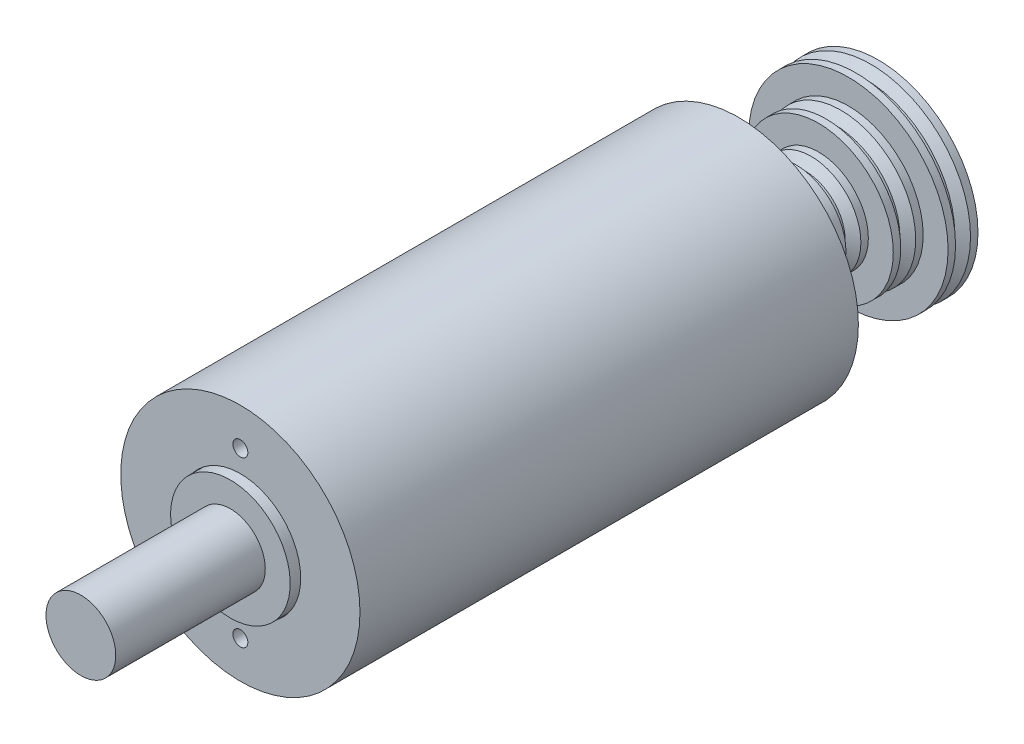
SolidWorks part; units mm, degrees
other "Spacer"
other "6201 DgFr"
other "Front Preload Nut"
other "7203 AngRr"
other "7203 AngFr"
other "Inner Spindle"
other "Lockring Rear"
other "Lockring Front"
other "Outer Spindle"
other "Rear Preload Nut"
other "6201 DgRr"
other "Pulley"
ref_plane "Front Plane" through (0, 0, 0) normal (0, 0, 1) x (1, 0, 0)
ref_plane "Top Plane" through (0, 0, 0) normal (0, 1, 0) x (1, 0, 0)
ref_plane "Right Plane" through (0, 0, 0) normal (1, 0, 0) x (0, 0, -1)
sketch "Sketch1" plane through (0, 0, 0) normal (1, 0, 0) x (0, 0, -1)
  line L0 (-126.3943, 0) -> (126.3943, 0) construction
  line L1 (-50, 23.3253) -> (-50, -23.3253) construction
  line L2 (50, 19.03) -> (50, -19.03) construction
  line L3 (-82, 0) -> (-82, 7)
  line L4 (-82, 7) -> (-52, 7)
  line L5 (-52, 7) -> (-52, 12)
  line L6 (-52, 12) -> (-48, 12)
  line L7 (-48, 12) -> (-48, 7.4)
  line L8 (-48, 7.4) -> (-44, 7.4)
  line L9 (-44, 7.4) -> (-44, 11)
  line L10 (-44, 11) -> (-40, 11)
  line L11 (-40, 11) -> (-40, 8.5)
  line L12 (-40, 8.5) -> (-16, 8.5)
  line L15 (-1, 8.45) -> (-1, 7.4)
  line L17 (-1, 7.4) -> (9, 7.4)
  line L18 (9, 7.4) -> (9, 6)
  line L21 (53, 5.95) -> (53, 5)
  line L22 (53, 5) -> (78, 5)
  line L23 (78, 5) -> (78, 0)
  line L24 (-82, 0) -> (78, 0)
  line L26 (-16, 7.5) -> (-14, 7.5)
  line L27 (-14, 7.5) -> (-14, 8.45)
  line L28 (-14, 8.45) -> (-1, 8.45)
  line L29 (9, 6) -> (39, 6)
  line L30 (39, 6) -> (39, 5)
  line L31 (39, 5) -> (41, 5)
  line L32 (41, 5) -> (41, 5.95)
  line L33 (41, 5.95) -> (53, 5.95)
  line L34 (-16, 8.5) -> (-16, 7.5)
  point P4 (0, 0)
  point P7 (-50, 0)
  point P10 (50, 0)
  point P38 (-16, 8)
  dimension "D1" = 50
  dimension "D2" = 50
  dimension "D3" = 7
  dimension "D4" = 30
  dimension "D5" = 12
  dimension "D6" = 4
  dimension "D7" = 7.4
  dimension "D8" = 2
  dimension "D9" = 6
  dimension "D10" = 11
  dimension "D11" = 4
  dimension "D12" = 8.5
  dimension "D13" = 24
  dimension "D14" = 8.45
  dimension "D15" = 2
  dimension "D16" = 15
  dimension "D17" = 41
  dimension "D18" = 6
  dimension "D19" = 7.5
  dimension "D20" = 30
  dimension "D21" = 7.4
  dimension "D22" = 3
  dimension "D23" = 5
  dimension "D24" = 25
  dimension "D25" = 5.95
  dimension "D26" = 2
  dimension "D27" = 5
revolve "Revolve2" add sketch "Sketch1" angle 360 about L0
sketch "Sketch5" plane through (0, 0, 40) normal (0, 0, -1) x (-1, 0, 0)
  circle A0 centre (0, 0) radius 8.5 construction
  circle A1 centre (0, 0) radius 8.5
  circle A2 centre (0, 0) radius 20
  dimension "D1" = 40
extrude "Boss-Extrude1" add sketch "Sketch5" along normal blind 12 separate body
sketch "Sketch6" plane through (0, 0, 28) normal (0, 0, -1) x (-1, 0, 0)
  circle A0 centre (0, 0) radius 8.5 construction
  circle A1 centre (0, 0) radius 8.5
  circle A2 centre (0, 0) radius 20
  dimension "D1" = 40
extrude "Boss-Extrude2" add sketch "Sketch6" along normal blind 12 separate body
sketch "Sketch7" plane through (0, 0, 16) normal (0, 0, -1) x (-1, 0, 0)
  circle A2 centre (0, 0) radius 12
  circle A7 centre (0, 0) radius 9
  circle A8 centre (0, 0) radius 9
  dimension "D1" = 24
  dimension "D2" = 0.5
extrude "Boss-Extrude3" add sketch "Sketch7" along normal blind 2 separate body
sketch "Sketch8" plane through (0, 0, 14) normal (0, 0, -1) x (-1, 0, 0)
  circle A0 centre (0, 0) radius 17.5
  circle A5 centre (0, 0) radius 8.45 construction
  circle A6 centre (0, 0) radius 8.45 construction
  circle A7 centre (0, 0) radius 8.05
  dimension "D1" = 35
  dimension "D2" = 16.1
extrude "Boss-Extrude4" add sketch "Sketch8" along normal blind 8
sketch "Sketch32" plane through (0, 0, 6) normal (0, 0, -1) x (-1, 0, 0)
  line L0 (0, -13) -> (0, 13) construction
  circle A0 centre (0, 0) radius 13 construction
  circle A2 centre (0, -13) radius 1.6
  circle A3 centre (0, 13) radius 1.6
  dimension "D1" = 26
  dimension "D2" = 3.2
extrude "Cut-Extrude9" cut sketch "Sketch32" against normal blind 5
sketch "Sketch9" plane through (0, 0, -9) normal (0, 0, -1) x (-1, 0, 0)
  circle A0 centre (0, 0) radius 6 construction
  circle A1 centre (0, 0) radius 6
  circle A2 centre (0, 0) radius 16
  dimension "D1" = 32
extrude "Boss-Extrude5" add sketch "Sketch9" along normal blind 10 separate body
sketch "Sketch11" plane through (0, 0, -19) normal (0, 0, -1) x (-1, 0, 0)
  circle A0 centre (0, 0) radius 16 construction
  circle A1 centre (0, 0) radius 16
  circle A2 centre (0, 0) radius 14
  circle A3 centre (0, 0) radius 15.5
  dimension "D1" = 28
  dimension "D2" = 31
extrude "Boss-Extrude8" add sketch "Sketch11" along normal blind 10 separate body contours A3 A2
sketch "Sketch12" plane through (0, 0, -29) normal (0, 0, -1) x (-1, 0, 0)
  circle A0 centre (0, 0) radius 6 construction
  circle A1 centre (0, 0) radius 6
  circle A2 centre (0, 0) radius 16
  dimension "D1" = 32
extrude "Boss-Extrude9" add sketch "Sketch12" along normal blind 10 separate body
sketch "Sketch13" plane through (0, 0, -39) normal (0, 0, -1) x (-1, 0, 0)
  circle A2 centre (0, 0) radius 8
  circle A5 centre (0, 0) radius 6.5
  circle A6 centre (0, 0) radius 6.5
  dimension "D1" = 16
  dimension "D2" = 0.5
extrude "Boss-Extrude10" add sketch "Sketch13" along normal blind 2 separate body
sketch "Sketch14" plane through (0, 0, -41) normal (0, 0, -1) x (-1, 0, 0)
  circle A0 centre (0, 0) radius 12
  circle A5 centre (0, 0) radius 5.55
  dimension "D1" = 24
  dimension "D2" = 11.1
extrude "Boss-Extrude11" add sketch "Sketch14" along normal blind 8
sketch "Sketch33" plane through (0, 0, -49) normal (0, 0, -1) x (-1, 0, 0)
  line L0 (0, 8.75) -> (0, -8.75) construction
  circle A0 centre (0, 0) radius 8.75 construction
  circle A1 centre (0, -8.75) radius 1.6
  circle A2 centre (0, 8.75) radius 1.6
  dimension "D1" = 17.5
  dimension "D2" = 3.2
extrude "Cut-Extrude10" cut sketch "Sketch33" against normal blind 5
sketch "Sketch15" plane through (0, 0, 0) normal (0, 0, 1) x (1, 0, 0)
  circle A0 centre (0, 0) radius 24
  dimension "D1" = 48
extrude "Boss-Extrude12" add sketch "Sketch15" along normal mid plane 100 separate body
sketch "Sketch16" plane through (0, 0, -50) normal (0, 0, -1) x (-1, 0, 0)
  circle A0 centre (0, 0) radius 16
  dimension "D1" = 32
extrude "Cut-Extrude1" cut sketch "Sketch16" against normal up to next (100 mm away)
sketch "Sketch17" plane through (0, 0, -50) normal (0, 0, -1) x (-1, 0, 0)
  circle A0 centre (0, 0) radius 21
  circle A1 centre (0, 0) radius 16 construction
  circle A2 centre (0, 0) radius 16
  dimension "D1" = 42
extrude "Cut-Extrude2" cut sketch "Sketch17" against normal blind 11
sketch "Sketch18" plane through (0, 0, 50) normal (0, 0, 1) x (1, 0, 0)
  circle A0 centre (0, 0) radius 20
  circle A1 centre (0, 0) radius 16 construction
  circle A2 centre (0, 0) radius 16
  dimension "D1" = 40
extrude "Cut-Extrude3" cut sketch "Sketch18" against normal blind 34
sketch "Sketch19" plane through (0, 0, 16) normal (0, 0, 1) x (1, 0, 0)
  circle A0 centre (0, 0) radius 18
  circle A1 centre (0, 0) radius 16 construction
  circle A2 centre (0, 0) radius 16
  dimension "D1" = 36
extrude "Cut-Extrude4" cut sketch "Sketch19" against normal blind 14
sketch "Sketch20" plane through (0, 0, 50) normal (0, 0, 1) x (1, 0, 0)
  circle A0 centre (0, 0) radius 21
  circle A1 centre (0, 0) radius 20 construction
  circle A2 centre (0, 0) radius 20
  dimension "D1" = 42
extrude "Cut-Extrude5" cut sketch "Sketch20" against normal blind 10
sketch "Sketch21" plane through (0, 0, 50) normal (0, 0, 1) x (1, 0, 0)
  circle A0 centre (0, 0) radius 12.1
  circle A1 centre (0, 0) radius 21 construction
  circle A2 centre (0, 0) radius 21
  dimension "D1" = 24.2
extrude "Boss-Extrude13" add sketch "Sketch21" against normal blind 10 separate body
sketch "Sketch22" plane through (0, 0, 50) normal (0, 0, 1) x (1, 0, 0)
  line L0 (0, -16.5) -> (0, 16.5) construction
  circle A0 centre (0, 0) radius 16.5 construction
  circle A1 centre (0, -16.5) radius 1.5
  circle A2 centre (0, 16.5) radius 1.5
  dimension "D1" = 33
  dimension "D2" = 3
extrude "Cut-Extrude6" cut sketch "Sketch22" against normal blind 5
sketch "Sketch23" plane through (0, 0, -50) normal (0, 0, -1) x (-1, 0, 0)
  circle A0 centre (0, 0) radius 12.1
  circle A1 centre (0, 0) radius 21 construction
  circle A2 centre (0, 0) radius 21
  dimension "D1" = 24.2
extrude "Boss-Extrude14" add sketch "Sketch23" against normal blind 10 separate body
sketch "Sketch24" plane through (0, 0, -50) normal (0, 0, -1) x (-1, 0, 0)
  line L0 (16.5, 0) -> (-16.5, 0) construction
  circle A0 centre (0, 0) radius 16.5 construction
  circle A1 centre (16.5, 0) radius 2.5
  circle A2 centre (-16.5, 0) radius 2.5
  dimension "D1" = 33
  dimension "D2" = 5
extrude "Cut-Extrude7" cut sketch "Sketch24" against normal blind 5 contours A1 | A2
sketch "Sketch26" plane through (0, 0, 0) normal (1, 0, 0) x (0, 0, -1)
  line L0 (78, -5) -> (78, 5) construction
  line L2 (50.5679, 0) -> (99.549, 0) construction
  line L4 (72, 15) -> (70.5, 15)
  line L5 (70.5, 15) -> (69.3453, 13)
  line L6 (69.3453, 13) -> (68.6547, 13)
  line L7 (68.6547, 13) -> (67.5, 15)
  line L8 (67.5, 15) -> (66, 15)
  line L9 (66, 15) -> (66, 10)
  line L10 (66, 10) -> (64.5, 10)
  line L11 (64.5, 10) -> (63.3453, 8)
  line L12 (63.3453, 8) -> (62.6547, 8)
  line L13 (62.6547, 8) -> (61.5, 10)
  line L14 (61.5, 10) -> (54.5, 10)
  line L15 (54.5, 10) -> (54.5, 5)
  line L16 (54.5, 5) -> (78, 5)
  line L17 (72, 15) -> (72, 20)
  line L19 (78, 20) -> (78, 5)
  line L20 (72, 20) -> (73.5, 20)
  line L21 (73.5, 20) -> (74.6547, 18)
  line L22 (74.6547, 18) -> (75.3453, 18)
  line L23 (75.3453, 18) -> (76.5, 20)
  line L24 (76.5, 20) -> (78, 20)
  line L25 (78, -5) -> (78, 5) construction
  point P19 (71.25, 15)
  point P28 (65.25, 10)
  dimension "D1" = 15
  dimension "D2" = 5
  dimension "D3" = 20
  dimension "D4" = 2
  dimension "D5" = 3
  dimension "D6" = 1.5
  dimension "D8" = 7
  dimension "D10" = 60
  dimension "D11" = 60
  dimension "D13" = 10
revolve "Revolve4" add sketch "Sketch26" angle 360 about L2
sketch "Sketch29" plane through (0, 0, 40) normal (0, 0, -1) x (-1, 0, 0)
  circle A0 centre (0, 0) radius 17.5
  circle A1 centre (0, 0) radius 12.1 construction
  circle A2 centre (0, 0) radius 12.1
  circle A4 centre (0, 0) radius 21 construction
  circle A5 centre (0, 0) radius 19.8
  circle A6 centre (0, 0) radius 19.8
  circle A7 centre (0, 0) radius 21
  dimension "D1" = 35
  dimension "D2" = 0.2
extrude "Cut-Extrude8" cut sketch "Sketch29" against normal blind 1 contours A0 M4 | A6 M5
sketch "Sketch30" plane through (0, 0, -40) normal (0, 0, 1) x (1, 0, 0)
  circle A0 centre (0, 0) radius 12.1 construction
  circle A3 centre (0, 0) radius 14.1
  circle A4 centre (0, 0) radius 15.75
  circle A5 centre (0, 0) radius 12.1 construction
  dimension "D1" = 31.5
  dimension "D2" = 28.2
extrude "Boss-Extrude15" add sketch "Sketch30" along normal up to surface (1 mm away)
combine bodies "Combine1" operation type add bodies to combine 102 131 130 122 133 112 111 108 132 105 104 128
